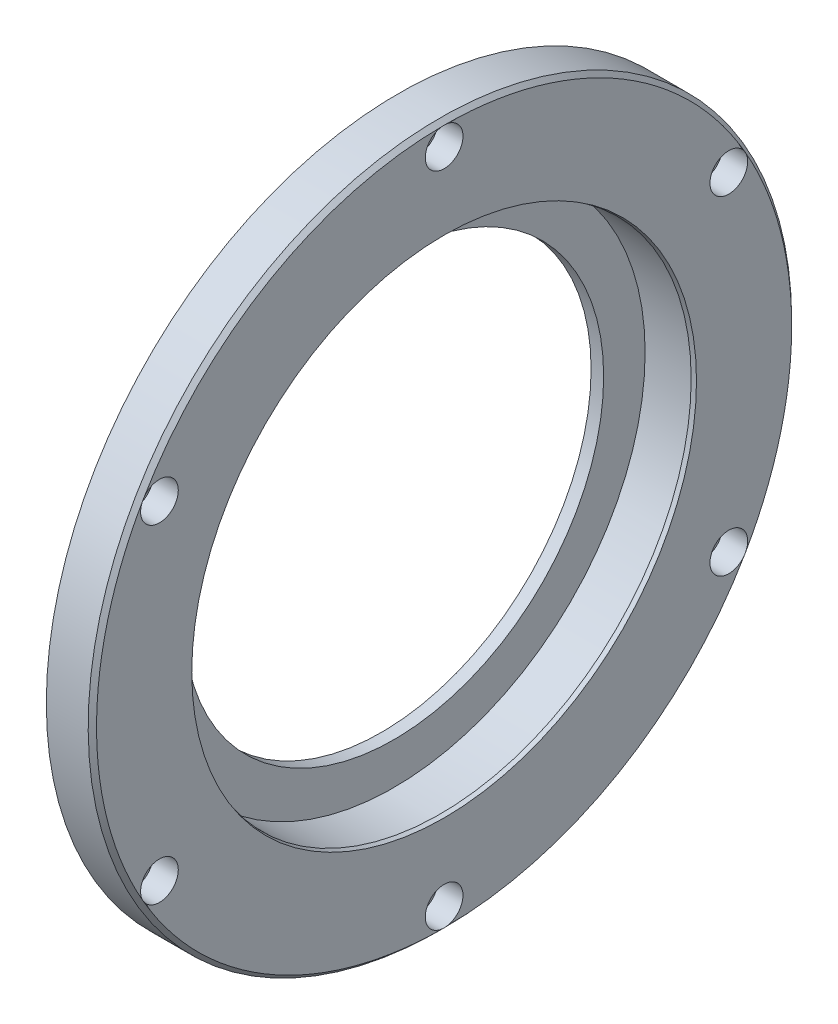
SolidWorks part; units mm, degrees
ref_plane "Face" through (0, 0, 0) normal (0, 0, 1) x (1, 0, 0)
ref_plane "Cote" through (0, 0, 0) normal (0, 1, 0) x (1, 0, 0)
ref_plane "Dessus" through (0, 0, 0) normal (1, 0, 0) x (0, 0, -1)
sketch "Esquisse1" plane through (0, 0, 0) normal (0, 0, 1) x (1, 0, 0)
  line L0 (0, 0) -> (-33.0849, 0) construction
  line L1 (-16, 74.4226) -> (-16, 65)
  line L2 (-16, 65) -> (-15, 65)
  line L3 (-15, 65) -> (-15, 50.1)
  line L4 (-15, 50.1) -> (-12, 50.1)
  line L5 (-12, 50.1) -> (-12, 60)
  line L6 (-12, 60) -> (-1, 60)
  line L7 (-1, 60) -> (0, 60.2679)
  line L8 (0, 60.2679) -> (0, 83)
  line L9 (0, 83) -> (-1, 84)
  line L10 (-1, 84) -> (-11, 84)
  line L11 (-11, 84) -> (-11, 75)
  line L12 (-11, 75) -> (-15, 75)
  line L13 (-15, 75) -> (-16, 74.4226)
  dimension "D1" = 100.2
  dimension "D2" = 130
  dimension "D3" = 150
  dimension "D4" = 120
  dimension "D5" = 168
  dimension "D6" = 45
  dimension "D7" = 1
  dimension "D8" = 15
  dimension "D9" = 1
  dimension "D10" = 12
  dimension "D11" = 30
  dimension "D12" = 1
  dimension "D13" = 5
  dimension "D14" = 1
  dimension "D15" = 16
revolve "profil" add sketch "Esquisse1" angle 360 about L0
sketch "axes" plane through (0, 0, 0) normal (1, 0, 0) x (0, 0, -1)
  line L0 (0, 95.7493) -> (0, -93.5782) construction
  line L1 (-99.8746, 0) -> (95.9665, 0) construction
  line L2 (78.6046, 45.3824) -> (-78.6046, -45.3824) construction
  line L3 (-80.0699, 46.2284) -> (80.0699, -46.2284) construction
  circle A0 centre (0, 0) radius 78.5 construction
  dimension "D3" = 157
  dimension "D1" = 30
  dimension "D2" = 30
hole_wizard "1er logement vis" positions "Esquisse4" profile "Esquisse3" counterbore size "M1.6" standard "ISO"
sketch "Esquisse4" plane through (0, 0, 0) normal (1, 0, 0) x (0, 0, -1)
  line L0 (0, 95.7493) -> (0, -93.5782) construction
  circle A0 centre (0, 0) radius 78.5 construction
  point P0 (0, 78.5)
sketch "Esquisse3" plane through (0, 78.5, 0) normal (0, 1, 0) x (0, 0, -1)
  line L0 (0, 0) -> (0, 16)
  line L1 (0, 16) -> (3, 16)
  line L3 (3, 16) -> (3, 6)
  line L4 (3, 6) -> (4.5, 6)
  line L5 (4.5, 6) -> (4.5, 0)
  line L7 (4.5, 0) -> (0, 0)
  line L11 (0, -6.35) -> (0, 107.95) construction
  dimension "Diamètre du perçage jusqu'au prochain" = 6
  dimension "Profondeur du perçage jusqu'au prochain" = 16
  dimension "Diamètre du chambrage" = 9
  dimension "Profondeur du chambrage" = 6
pattern_circular "6 logements vis" count 6 over 360 about axis through (0, 0, 0) along (1, 0, 0) of "1er logement vis"
